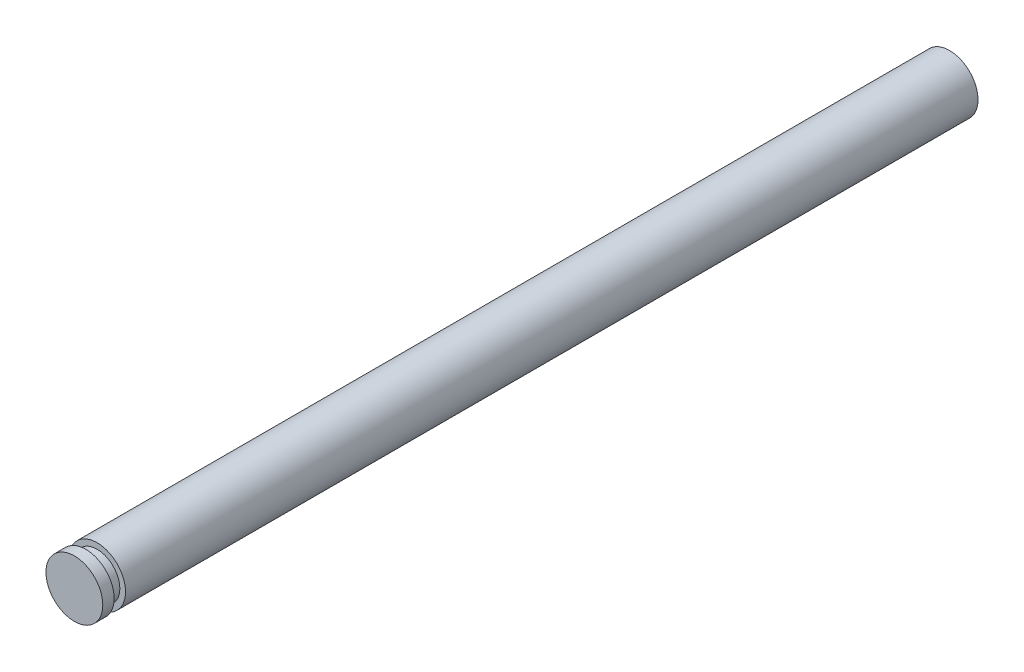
SolidWorks part; units mm, degrees
ref_plane "Спереди" through (0, 0, 0) normal (0, 0, 1) x (1, 0, 0)
ref_plane "Сверху" through (0, 0, 0) normal (0, 1, 0) x (1, 0, 0)
ref_plane "Справа" through (0, 0, 0) normal (1, 0, 0) x (0, 0, -1)
sketch "Эскиз1" plane through (0, 0, 0) normal (0, 0, 1) x (1, 0, 0)
  circle A0 centre (0, 0) radius 2.5
  dimension "D1" = 5
extrude "Бобышка-Вытянуть1" add sketch "Эскиз1" along normal blind 2 and the other way blind 75
ref_plane "Плоскость4" through (0, 0, 1) normal (0, 0, 1) x (1, 0, 0)
sketch "Эскиз2" plane through (0, 0, 1) normal (0, 0, 1) x (1, 0, 0)
  circle A0 centre (0, 0) radius 2
  circle A1 centre (0, 0) radius 3.2102
  dimension "D1" = 4
extrude "Вырез-Вытянуть1" cut sketch "Эскиз2" against normal blind 1
sketch3d "Трехмерный эскиз1"
  line L0 (0, 0, -75) -> (0, 0, 0) construction
  line L1 (0, 0, -75) -> (0, 0, 0) construction
  line L2 (0, 0, -75) -> (-2.5, 0, -75) construction
  circle A0 centre (0, 0, -75) radius 2.5 construction
  point P8 (0, 0, -72.5)
